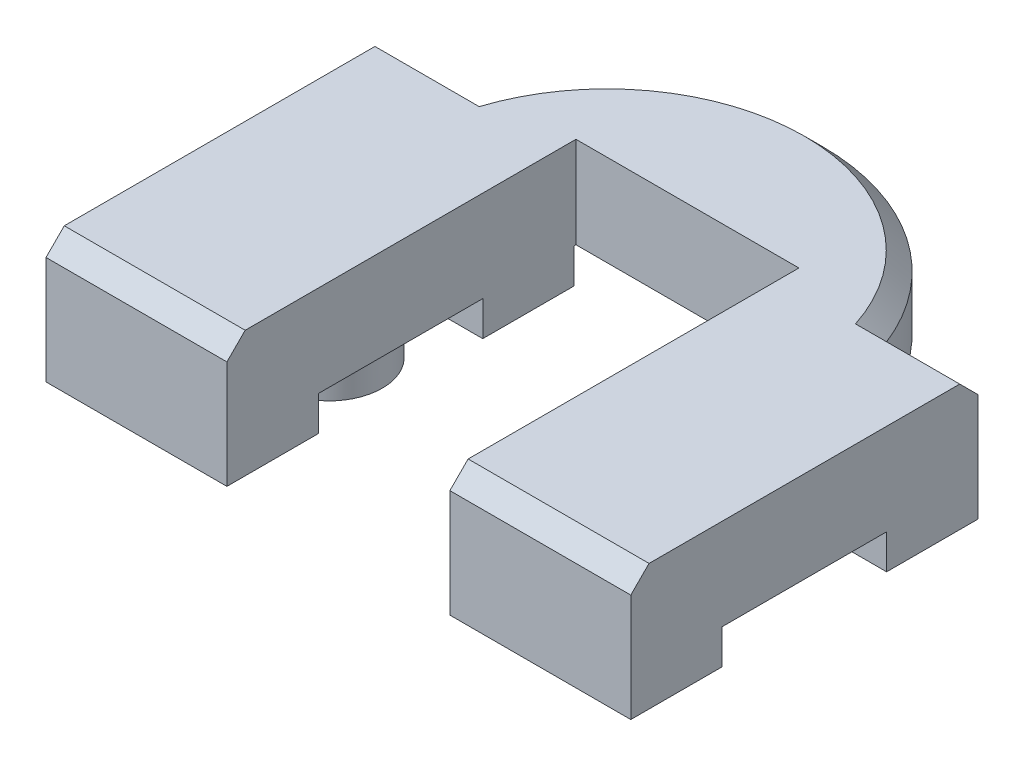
SolidWorks part; units mm, degrees
ref_plane "Front Plane" through (0, 0, 0) normal (0, 0, 1) x (1, 0, 0)
ref_plane "Top Plane" through (0, 0, 0) normal (0, 1, 0) x (1, 0, 0)
ref_plane "Right Plane" through (0, 0, 0) normal (1, 0, 0) x (0, 0, -1)
sketch "Sketch2" plane through (0, 0, 0) normal (0, 1, 0) x (1, 0, 0)
  line L1 (6, -6) -> (-6, -6)
  line L2 (6, -6) -> (6, 6)
  line L3 (6, 6) -> (-6, 6)
  line L4 (-6, -6) -> (-6, 6)
  line L5 (6, -6) -> (-6, 6) construction
  line L6 (6, 6) -> (-6, -6) construction
  line L9 (30, 4.5) -> (-30, 4.5)
  line L10 (30, 4.5) -> (30, -4.5)
  line L11 (30, -4.5) -> (-30, -4.5)
  line L12 (-30, 4.5) -> (-30, -4.5)
  line L13 (30, 4.5) -> (-30, -4.5) construction
  line L14 (30, -4.5) -> (-30, 4.5) construction
  circle A0 centre (-10, 0) radius 3
  circle A1 centre (10, 0) radius 3
  circle A2 centre (-30, 0) radius 3
  circle A3 centre (30, 0) radius 3
  point P0 (0, 0)
sketch "Sketch3" plane through (0, 0, 0) normal (0, 1, 0) x (1, 0, 0)
  line L3 (-16, -9.5) -> (-6.1, -9.5)
  line L5 (-11, 9.5) -> (-16, 9.5)
  line L6 (-16, 9.5) -> (-16, -9.5)
  line L9 (11, 9.5) -> (16, 9.5)
  line L10 (16, 9.5) -> (16, -9.5)
  line L11 (16, -9.5) -> (6.1, -9.5)
  line L16 (-6.1, 9.6) -> (6.1, 9.6)
  line L18 (-6.1, 9.6) -> (-6.1, -9.5)
  line L20 (6.1, 9.6) -> (6.1, -9.5)
  arc A0 (-11, 9.5) -> (11, 9.5) centre (0, 5.1833) cw
extrude "Boss-Extrude1" add sketch "Sketch3" along normal blind 5
sketch "Sketch4" plane through (0, 0, 0) normal (0, 1, 0) x (1, 0, 0)
  line L0 (-16, 4.5) -> (-6.1, 4.5)
  line L4 (30, 4.5) -> (-30, 4.5) construction
  line L5 (-16, 9.5) -> (-16, -9.5) construction
  line L6 (-6.1, -9.5) -> (-6.1, 9.6) construction
  line L7 (-6.1, 4.5) -> (-6.1, 9.5)
  line L8 (-16, 4.5) -> (-16, 9.5)
  line L9 (-16, 9.5) -> (-6.1, 9.5)
  line L10 (-16, -4.5) -> (-6.1, -4.5)
  line L11 (30, -4.5) -> (-30, -4.5) construction
  line L12 (-6.1, -4.5) -> (-6.1, -9.5)
  line L13 (-6.1, -9.5) -> (-16, -9.5)
  line L14 (-16, -9.5) -> (-16, -4.5)
  line L15 (6.1, 4.5) -> (16, 4.5)
  line L16 (16, 9.5) -> (6.1, 9.5)
  line L17 (6.1, 9.6) -> (6.1, -9.5) construction
  line L18 (6.1, 9.5) -> (6.1, 4.5)
  line L19 (16, 4.5) -> (16, 9.5)
  line L20 (6.1, -4.5) -> (16, -4.5)
  line L21 (16, -4.5) -> (16, -9.5)
  line L22 (16, -9.5) -> (6.1, -9.5)
  line L23 (6.1, -9.5) -> (6.1, -4.5)
extrude "Boss-Extrude2" add sketch "Sketch4" against normal blind 1.9
sketch "Sketch5" plane through (0, 0, 0) normal (0, 1, 0) x (1, 0, 0)
  circle A0 centre (-10, 0) radius 2.9
  circle A1 centre (10, 0) radius 2.9
extrude "Boss-Extrude3" add sketch "Sketch5" against normal blind 2.5
chamfer "Chamfer1" distance 1 angle 45 6 edges at (0, 0, -17) (13.5, 5, -9.5) (-13.5, 5, -9.5) (0, 5, -17) (11.05, 5, 9.5) (-11.05, 5, 9.5)
